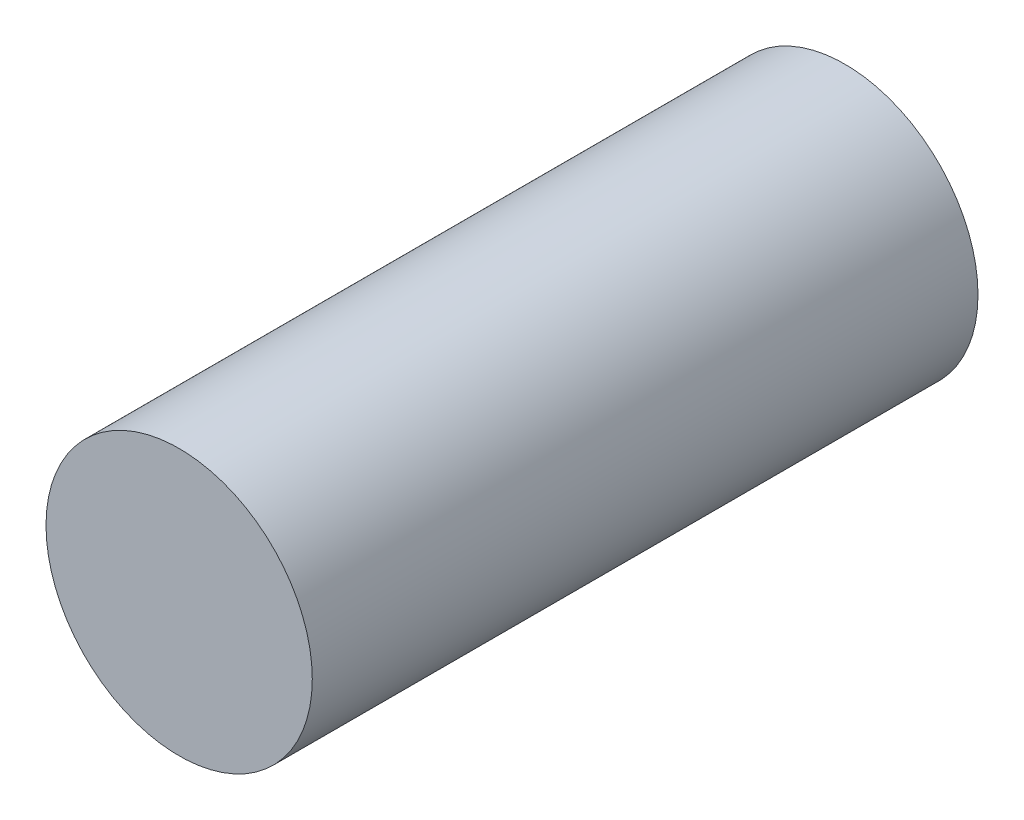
SolidWorks part; units mm, degrees
ref_plane "Plan de face" through (0, 0, 0) normal (0, 0, 1) x (1, 0, 0)
ref_plane "Plan de dessus" through (0, 0, 0) normal (0, 1, 0) x (1, 0, 0)
ref_plane "Plan de droite" through (0, 0, 0) normal (1, 0, 0) x (0, 0, -1)
sketch "Esquisse1" plane through (0, 0, 0) normal (0, 0, 1) x (1, 0, 0)
  circle A0 centre (0, 0) radius 4
  dimension "D1" = 8
extrude "Extrusion1" add sketch "Esquisse1" along normal blind 20
